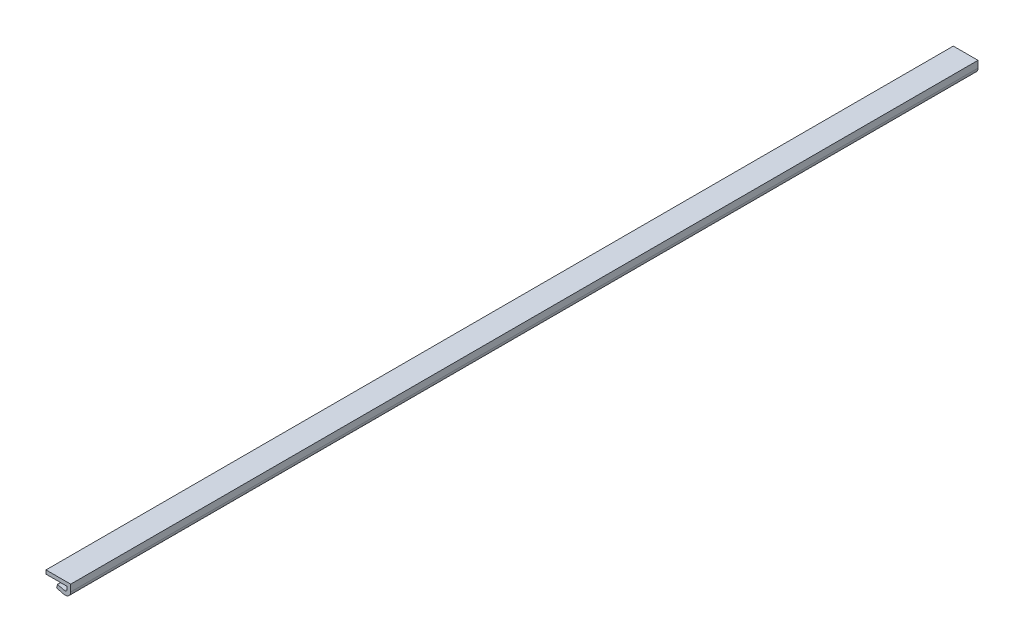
SolidWorks part; units mm, degrees
ref_plane "Plan de face" through (0, 0, 0) normal (0, 0, 1) x (1, 0, 0)
ref_plane "Plan de dessus" through (0, 0, 0) normal (0, 1, 0) x (1, 0, 0)
ref_plane "Plan de droite" through (0, 0, 0) normal (1, 0, 0) x (0, 0, -1)
sketch "Esquisse1" plane through (0, 0, 0) normal (0, 0, 1) x (1, 0, 0)
  line L0 (0, 0) -> (20, 0)
  line L1 (0, 0) -> (0, -3)
  line L2 (0, -3) -> (17, -3)
  line L3 (20, 0) -> (20, -5.5)
  line L4 (14.4114, -9.8663) -> (8.5739, -8.4109)
  line L5 (8.5739, -8.4109) -> (9.2997, -5.5)
  line L6 (9.2997, -5.5) -> (15.1371, -6.9554)
  line L7 (17, -3) -> (17, -5.5)
  arc A0 (20, -5.5) -> (14.4114, -9.8663) centre (15.5, -5.5) cw
  arc A1 (15.1371, -6.9554) -> (17, -5.5) centre (15.5, -5.5) ccw
  dimension "D5" = 1.5
  dimension "D1" = 20
  dimension "D2" = 3
  dimension "D3" = 17
  dimension "D4" = 5.5
  dimension "D6" = 76
  dimension "D7" = 2.5
extrude "Extrusion1" add sketch "Esquisse1" along normal blind 735
sketch "Esquisse2" plane through (0, 0, 735) normal (0, 0, 1) x (1, 0, 0)
  line L0 (0, 0) -> (20, 0)
  line L1 (20, 0) -> (20, -5.5)
  line L2 (14.4114, -9.8663) -> (8.5739, -8.4109)
  line L3 (8.5739, -8.4109) -> (9.2997, -5.5)
  line L4 (9.2997, -5.5) -> (15.1371, -6.9554)
  line L5 (17, -5.5) -> (17, -3)
  line L6 (17, -3) -> (0, -3)
  line L7 (0, -3) -> (0, 0)
  line L8 (-2.5369, -81) -> (22.7877, -81) construction
  arc A0 (20, -5.5) -> (14.4114, -9.8663) centre (15.5, -5.5) cw
  arc A1 (15.1371, -6.9554) -> (17, -5.5) centre (15.5, -5.5) ccw
  dimension "D1" = 78
revolve "Révolution1" [suppressed] add sketch "Esquisse2" angle 72.28 about L8
sketch "Esquisse3" [suppressed] plane through (0, 0, 0) normal (0, 0, -1) x (-1, 0, 0)
  line L0 (0, 0) -> (-20, 0)
  line L1 (-20, 0) -> (-20, -5.5)
  line L2 (-14.4114, -9.8663) -> (-8.5739, -8.4109)
  line L3 (-8.5739, -8.4109) -> (-9.2997, -5.5)
  line L4 (-9.2997, -5.5) -> (-15.1371, -6.9554)
  line L5 (-17, -5.5) -> (-17, -3)
  line L6 (-17, -3) -> (0, -3)
  line L7 (0, -3) -> (0, 0)
  line L8 (-30.2357, -81) -> (10.1051, -81) construction
  arc A0 (-20, -5.5) -> (-14.4114, -9.8663) centre (-15.5, -5.5) ccw
  arc A1 (-15.1371, -6.9554) -> (-17, -5.5) centre (-15.5, -5.5) cw
  dimension "D1" = 78
revolve "Révolution2" [suppressed] add sketch "Esquisse3" angle 72.28 about L8
